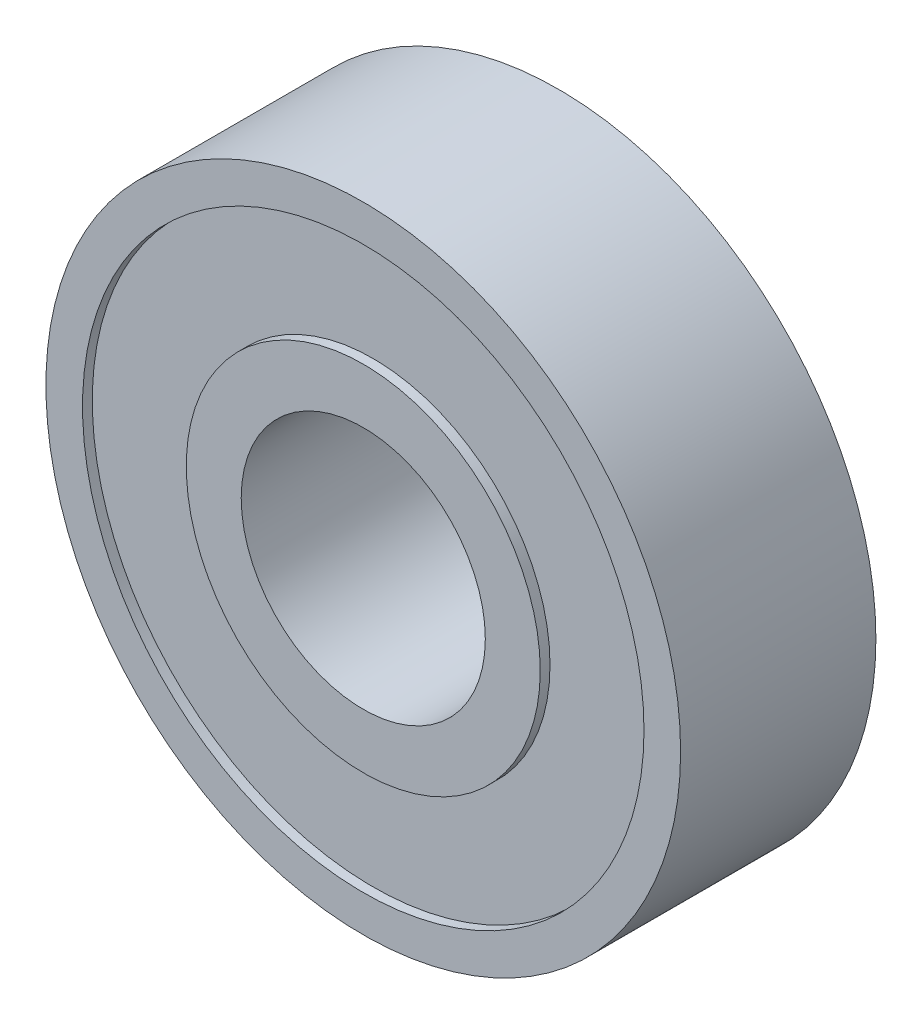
SolidWorks part; units mm, degrees
ref_plane "Front" through (0, 0, 0) normal (0, 0, 1) x (1, 0, 0)
ref_plane "Top" through (0, 0, 0) normal (0, 1, 0) x (1, 0, 0)
ref_plane "Right" through (0, 0, 0) normal (1, 0, 0) x (0, 0, -1)
sketch "Sketch1" plane through (0, 0, 0) normal (0, 0, 1) x (1, 0, 0)
  circle A0 centre (0, 0) radius 13
  circle A1 centre (0, 0) radius 5
  dimension "D1" = 26
  dimension "D2" = 10
extrude "Extrude1" add sketch "Sketch1" along normal mid plane 8
sketch "Sketch2" plane through (0, 0, 4) normal (0, 0, 1) x (1, 0, 0)
  circle A2 centre (0, 0) radius 7.25
  circle A3 centre (0, 0) radius 7.25
  circle A5 centre (0, 0) radius 11.5
  circle A6 centre (0, 0) radius 11.5
  dimension "D1" = 2.25
  dimension "D2" = 1.5
extrude "Cut-Extrude1" cut sketch "Sketch2" against normal blind 0.4
mirror "Mirror1" about plane through (0, 0, 0) normal (0, 0, 1) of "Cut-Extrude1"
